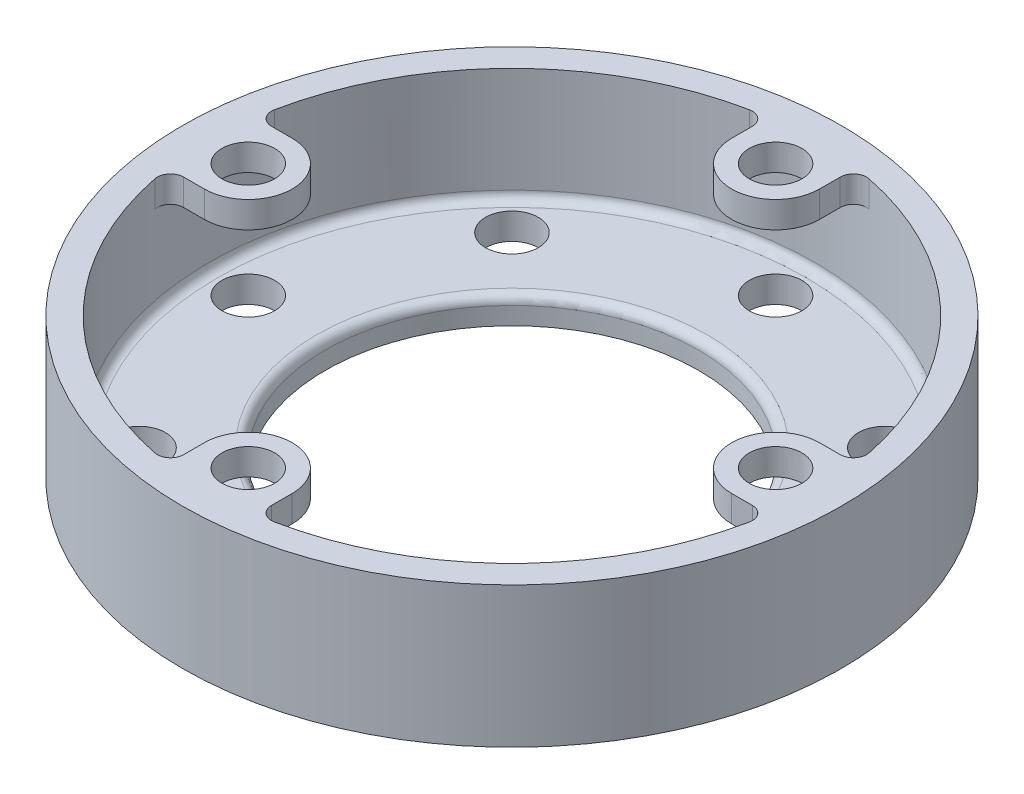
SolidWorks part; units mm, degrees
ref_plane "Front" through (0, 0, 0) normal (0, 0, 1) x (1, 0, 0)
ref_plane "Top" through (0, 0, 0) normal (0, 1, 0) x (1, 0, 0)
ref_plane "Right" through (0, 0, 0) normal (1, 0, 0) x (0, 0, -1)
sketch "Sketch1" plane through (0, 0, 0) normal (0, 1, 0) x (1, 0, 0)
  circle A0 centre (0, 0) radius 75
  dimension "D1" = 150
extrude "Base-Extrude" add sketch "Sketch1" along normal blind 32
shell "Shell1" thickness 6
sketch "Sketch4" plane through (0, 6, 0) normal (0, 1, 0) x (-1, 0, 0)
  circle A0 centre (0, 0) radius 42.5
  dimension "D1" = 85
extrude "Cut-Extrude2" cut sketch "Sketch4" against normal through all
sketch "Sketch2" plane through (0, 32, 0) normal (0, 1, 0) x (-1, 0, 0)
  line L0 (0, -75) -> (0, 75) construction
  line L1 (-10, -68.2715) -> (-10, -60)
  line L2 (10, -60) -> (10, -68.2715)
  circle A0 centre (0, 0) radius 75 construction
  arc A1 (-10, -68.2715) -> (10, -68.2715) centre (0, 0) ccw
  circle A2 centre (0, 0) radius 69 construction
  arc A3 (-10, -60) -> (10, -60) centre (0, -60) cw
  dimension "D2" = 10
  dimension "D1" = 60
extrude "Boss-Extrude1" add sketch "Sketch2" against normal blind 6
sketch "Sketch3" plane through (0, 32, 0) normal (0, 1, 0) x (-1, 0, 0)
  circle A0 centre (0, -60) radius 6
  arc A2 (10, -60) -> (-10, -60) centre (0, -60) ccw construction
  dimension "D1" = 12
extrude "Cut-Extrude1" cut sketch "Sketch3" against normal up to next
fillet "Fillet1" radius 3 2 edges at (-10, 29, -68.2715) (10, 29, -68.2715)
pattern_circular "CirPattern1" count 4 every 90 about axis through (0, 0, 0) along (0, 1, 0) of "Fillet1", "Boss-Extrude1", "Cut-Extrude1"
sketch "Sketch5" plane through (0, 6, 0) normal (0, 1, 0) x (-1, 0, 0)
  circle A0 centre (0, -60) radius 6 construction
  circle A1 centre (0, -60) radius 6
extrude "Cut-Extrude3" cut sketch "Sketch5" against normal through all
pattern_circular "CirPattern2" count 8 every 45 about axis through (0, 0, 0) along (0, 1, 0) of "Cut-Extrude3"
fillet "Fillet2" radius 2 2 edges at (0, 6, 69) (0, 6, 42.5)
